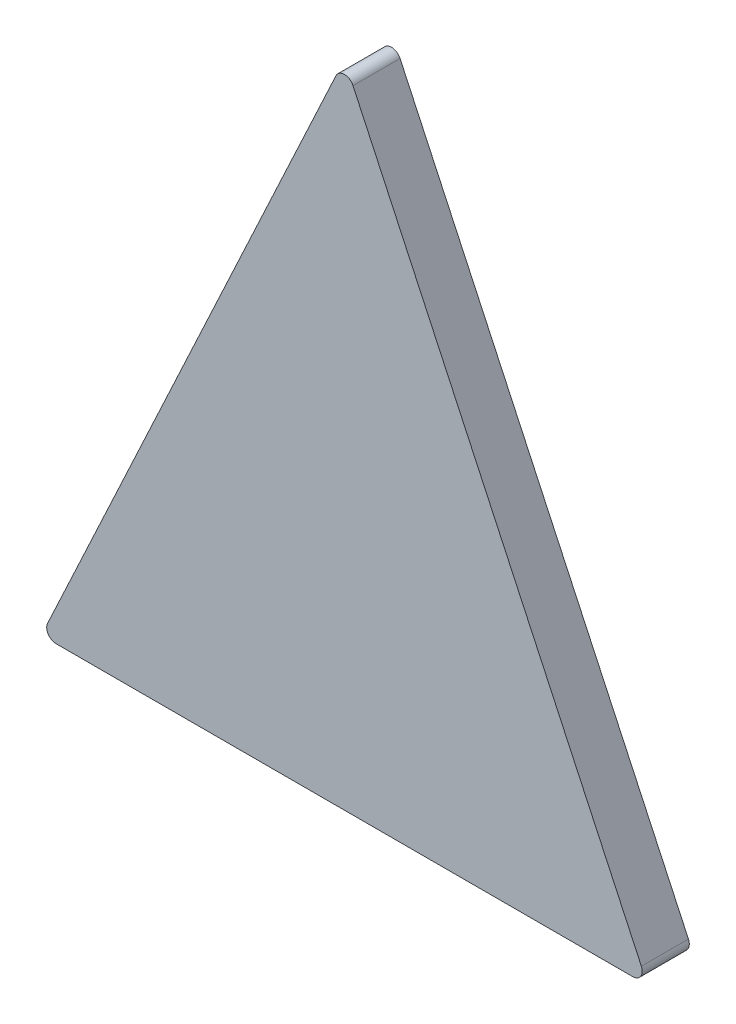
SolidWorks part; units mm, degrees
ref_plane "Front Plane" through (0, 0, 0) normal (0, 0, 1) x (1, 0, 0)
ref_plane "Top Plane" through (0, 0, 0) normal (0, 1, 0) x (1, 0, 0)
ref_plane "Right Plane" through (0, 0, 0) normal (1, 0, 0) x (0, 0, -1)
sketch "Sketch1" plane through (0, 0, 0) normal (0, 0, 1) x (1, 0, 0)
  line L0 (0, 0) -> (64.407, 0)
  line L1 (64.407, 0) -> (32.2035, 69.0607)
  line L2 (32.2035, 69.0607) -> (0, 0)
  dimension "D1" = 65
  dimension "D2" = 50
  dimension "D3" = 76.2
extrude "Boss-Extrude1" add sketch "Sketch1" along normal blind 5
fillet "Fillet1" radius 1 3 edges at (0, 0, 2.5) (64.407, 0, 2.5) (32.2035, 69.0607, 2.5)
